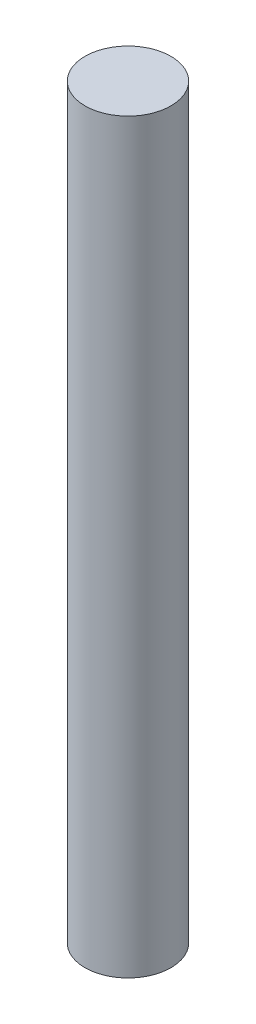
SolidWorks part; units mm, degrees
ref_plane "FRONT" through (0, 0, 0) normal (0, 0, 1) x (1, 0, 0)
ref_plane "TOP" through (0, 0, 0) normal (0, 1, 0) x (1, 0, 0)
ref_plane "RIGHT" through (0, 0, 0) normal (1, 0, 0) x (0, 0, -1)
sketch "Sketch1" plane through (0, 0, 0) normal (0, 1, 0) x (1, 0, 0)
  circle A0 centre (0, 0) radius 12.7
  dimension "D1" = 25.4
extrude "Boss-Extrude1" add sketch "Sketch1" along normal blind 220.6625
